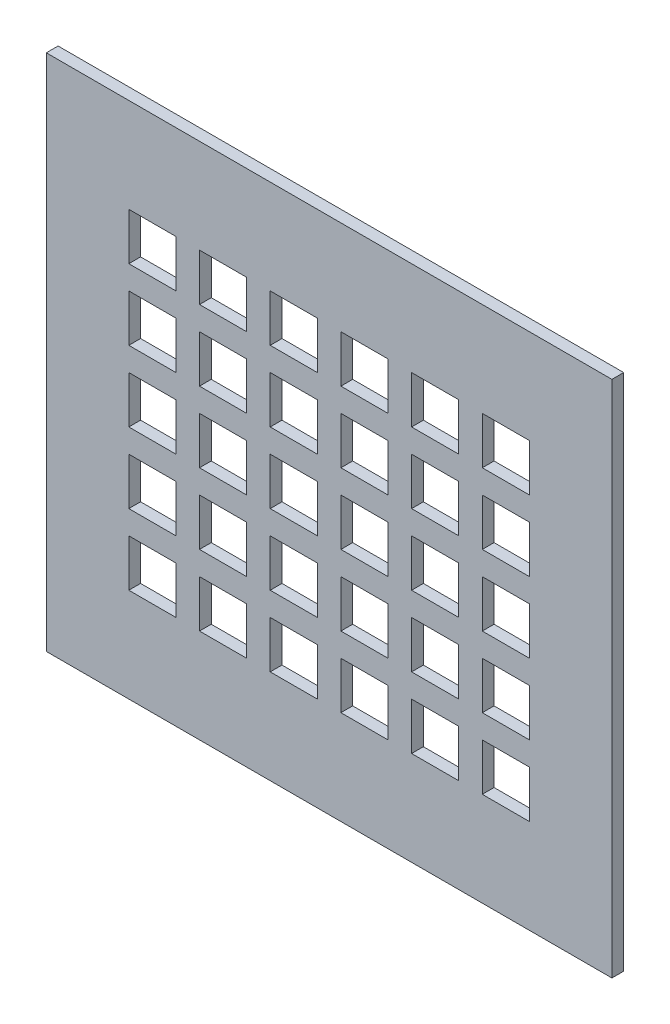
SolidWorks part; units mm, degrees
ref_plane "Front Plane" through (0, 0, 0) normal (0, 0, 1) x (1, 0, 0)
ref_plane "Top Plane" through (0, 0, 0) normal (0, 1, 0) x (1, 0, 0)
ref_plane "Right Plane" through (0, 0, 0) normal (1, 0, 0) x (0, 0, -1)
sketch "Sketch1" plane through (0, 0, 0) normal (0, 0, 1) x (1, 0, 0)
  line L1 (-76.2, 69.85) -> (76.2, 69.85)
  line L2 (-76.2, 69.85) -> (-76.2, -69.85)
  line L3 (-76.2, -69.85) -> (76.2, -69.85)
  line L4 (76.2, 69.85) -> (76.2, -69.85)
  line L5 (-76.2, 69.85) -> (76.2, -69.85) construction
  line L6 (-76.2, -69.85) -> (76.2, 69.85) construction
  point P0 (0, 0)
  dimension "D1" = 152.4
  dimension "D2" = 139.7
extrude "Boss-Extrude1" add sketch "Sketch1" along normal blind 3.175
sketch "Sketch3" plane through (0, 0, 3.175) normal (0, 0, 1) x (1, 0, 0)
  line L0 (-76.2, -69.85) -> (76.2, -69.85) construction
  line L1 (-53.975, -31.75) -> (-41.275, -31.75)
  line L2 (-53.975, -31.75) -> (-53.975, -44.45)
  line L3 (-53.975, -44.45) -> (-41.275, -44.45)
  line L4 (-41.275, -31.75) -> (-41.275, -44.45)
  line L5 (-53.975, -31.75) -> (-41.275, -44.45) construction
  line L6 (-53.975, -44.45) -> (-47.625, -38.1) construction
  line L7 (-76.2, 69.85) -> (-76.2, -69.85) construction
  line L8 (-34.925, -44.45) -> (-22.225, -44.45)
  line L9 (-22.225, -31.75) -> (-22.225, -44.45)
  line L10 (-34.925, -31.75) -> (-22.225, -31.75)
  line L11 (-34.925, -31.75) -> (-34.925, -44.45)
  line L12 (-15.875, -44.45) -> (-3.175, -44.45)
  line L13 (-3.175, -31.75) -> (-3.175, -44.45)
  line L14 (-15.875, -31.75) -> (-3.175, -31.75)
  line L15 (-15.875, -31.75) -> (-15.875, -44.45)
  line L16 (3.175, -44.45) -> (15.875, -44.45)
  line L17 (15.875, -31.75) -> (15.875, -44.45)
  line L18 (3.175, -31.75) -> (15.875, -31.75)
  line L19 (3.175, -31.75) -> (3.175, -44.45)
  line L20 (22.225, -44.45) -> (34.925, -44.45)
  line L21 (34.925, -31.75) -> (34.925, -44.45)
  line L22 (22.225, -31.75) -> (34.925, -31.75)
  line L23 (22.225, -31.75) -> (22.225, -44.45)
  line L24 (41.275, -44.45) -> (53.975, -44.45)
  line L25 (53.975, -31.75) -> (53.975, -44.45)
  line L26 (41.275, -31.75) -> (53.975, -31.75)
  line L27 (41.275, -31.75) -> (41.275, -44.45)
  line L28 (-34.925, -25.4) -> (-22.225, -25.4)
  line L29 (-22.225, -12.7) -> (-22.225, -25.4)
  line L30 (-34.925, -12.7) -> (-22.225, -12.7)
  line L31 (-34.925, -12.7) -> (-34.925, -25.4)
  line L32 (-15.875, -25.4) -> (-3.175, -25.4)
  line L33 (-3.175, -12.7) -> (-3.175, -25.4)
  line L34 (-15.875, -12.7) -> (-3.175, -12.7)
  line L35 (-15.875, -12.7) -> (-15.875, -25.4)
  line L36 (3.175, -25.4) -> (15.875, -25.4)
  line L37 (15.875, -12.7) -> (15.875, -25.4)
  line L38 (3.175, -12.7) -> (15.875, -12.7)
  line L39 (3.175, -12.7) -> (3.175, -25.4)
  line L40 (22.225, -25.4) -> (34.925, -25.4)
  line L41 (34.925, -12.7) -> (34.925, -25.4)
  line L42 (22.225, -12.7) -> (34.925, -12.7)
  line L43 (22.225, -12.7) -> (22.225, -25.4)
  line L44 (41.275, -25.4) -> (53.975, -25.4)
  line L45 (53.975, -12.7) -> (53.975, -25.4)
  line L46 (41.275, -12.7) -> (53.975, -12.7)
  line L47 (41.275, -12.7) -> (41.275, -25.4)
  line L48 (-34.925, -6.35) -> (-22.225, -6.35)
  line L49 (-22.225, 6.35) -> (-22.225, -6.35)
  line L50 (-34.925, 6.35) -> (-22.225, 6.35)
  line L51 (-34.925, 6.35) -> (-34.925, -6.35)
  line L52 (-15.875, -6.35) -> (-3.175, -6.35)
  line L53 (-3.175, 6.35) -> (-3.175, -6.35)
  line L54 (-15.875, 6.35) -> (-3.175, 6.35)
  line L55 (-15.875, 6.35) -> (-15.875, -6.35)
  line L56 (3.175, -6.35) -> (15.875, -6.35)
  line L57 (15.875, 6.35) -> (15.875, -6.35)
  line L58 (3.175, 6.35) -> (15.875, 6.35)
  line L59 (3.175, 6.35) -> (3.175, -6.35)
  line L60 (22.225, -6.35) -> (34.925, -6.35)
  line L61 (34.925, 6.35) -> (34.925, -6.35)
  line L62 (22.225, 6.35) -> (34.925, 6.35)
  line L63 (22.225, 6.35) -> (22.225, -6.35)
  line L64 (41.275, -6.35) -> (53.975, -6.35)
  line L65 (53.975, 6.35) -> (53.975, -6.35)
  line L66 (41.275, 6.35) -> (53.975, 6.35)
  line L67 (41.275, 6.35) -> (41.275, -6.35)
  line L68 (-34.925, 12.7) -> (-22.225, 12.7)
  line L69 (-22.225, 25.4) -> (-22.225, 12.7)
  line L70 (-34.925, 25.4) -> (-22.225, 25.4)
  line L71 (-34.925, 25.4) -> (-34.925, 12.7)
  line L72 (-15.875, 12.7) -> (-3.175, 12.7)
  line L73 (-3.175, 25.4) -> (-3.175, 12.7)
  line L74 (-15.875, 25.4) -> (-3.175, 25.4)
  line L75 (-15.875, 25.4) -> (-15.875, 12.7)
  line L76 (3.175, 12.7) -> (15.875, 12.7)
  line L77 (15.875, 25.4) -> (15.875, 12.7)
  line L78 (3.175, 25.4) -> (15.875, 25.4)
  line L79 (3.175, 25.4) -> (3.175, 12.7)
  line L80 (22.225, 12.7) -> (34.925, 12.7)
  line L81 (34.925, 25.4) -> (34.925, 12.7)
  line L82 (22.225, 25.4) -> (34.925, 25.4)
  line L83 (22.225, 25.4) -> (22.225, 12.7)
  line L84 (41.275, 12.7) -> (53.975, 12.7)
  line L85 (53.975, 25.4) -> (53.975, 12.7)
  line L86 (41.275, 25.4) -> (53.975, 25.4)
  line L87 (41.275, 25.4) -> (41.275, 12.7)
  line L88 (-34.925, 31.75) -> (-22.225, 31.75)
  line L89 (-22.225, 44.45) -> (-22.225, 31.75)
  line L90 (-34.925, 44.45) -> (-22.225, 44.45)
  line L91 (-34.925, 44.45) -> (-34.925, 31.75)
  line L92 (-15.875, 31.75) -> (-3.175, 31.75)
  line L93 (-3.175, 44.45) -> (-3.175, 31.75)
  line L94 (-15.875, 44.45) -> (-3.175, 44.45)
  line L95 (-15.875, 44.45) -> (-15.875, 31.75)
  line L96 (3.175, 31.75) -> (15.875, 31.75)
  line L97 (15.875, 44.45) -> (15.875, 31.75)
  line L98 (3.175, 44.45) -> (15.875, 44.45)
  line L99 (3.175, 44.45) -> (3.175, 31.75)
  line L100 (22.225, 31.75) -> (34.925, 31.75)
  line L101 (34.925, 44.45) -> (34.925, 31.75)
  line L102 (22.225, 44.45) -> (34.925, 44.45)
  line L103 (22.225, 44.45) -> (22.225, 31.75)
  line L104 (41.275, 31.75) -> (53.975, 31.75)
  line L105 (53.975, 44.45) -> (53.975, 31.75)
  line L106 (41.275, 44.45) -> (53.975, 44.45)
  line L107 (41.275, 44.45) -> (41.275, 31.75)
  line L108 (-53.975, -25.4) -> (-41.275, -25.4)
  line L109 (-41.275, -12.7) -> (-41.275, -25.4)
  line L110 (-53.975, -12.7) -> (-41.275, -12.7)
  line L111 (-53.975, -12.7) -> (-53.975, -25.4)
  line L112 (-53.975, -6.35) -> (-41.275, -6.35)
  line L113 (-41.275, 6.35) -> (-41.275, -6.35)
  line L114 (-53.975, 6.35) -> (-41.275, 6.35)
  line L115 (-53.975, 6.35) -> (-53.975, -6.35)
  line L116 (-53.975, 12.7) -> (-41.275, 12.7)
  line L117 (-41.275, 25.4) -> (-41.275, 12.7)
  line L118 (-53.975, 25.4) -> (-41.275, 25.4)
  line L119 (-53.975, 25.4) -> (-53.975, 12.7)
  line L120 (-53.975, 31.75) -> (-41.275, 31.75)
  line L121 (-41.275, 44.45) -> (-41.275, 31.75)
  line L122 (-53.975, 44.45) -> (-41.275, 44.45)
  line L123 (-53.975, 44.45) -> (-53.975, 31.75)
  line L124 (-34.925, -31.75) -> (-22.225, -44.45) construction
  line L125 (-34.925, -44.45) -> (-28.575, -38.1) construction
  point P0 (-47.625, -38.1)
  point P7 (-47.625, -44.45)
  dimension "D1" = 25.4
  dimension "D2" = 12.7
  dimension "D3" = 12.7
  dimension "D4" = 22.225
  dimension "D5" = 6
  dimension "D6" = 5
extrude "Cut-Extrude1" cut sketch "Sketch3" against normal through all
sketch "Sketch4" plane through (0, 0, 3.175) normal (0, 0, 1) x (1, 0, 0)
  line L0 (-76.2, -69.85) -> (76.2, 69.85) construction
  line L1 (-76.2, 69.85) -> (76.2, -69.85) construction
  line L2 (76.2, 69.85) -> (-76.2, 69.85) construction
  line L5 (-76.2, -69.85) -> (76.2, -69.85) construction
  point P8 (-65.8091, -60.325)
  point P9 (-65.8091, 60.325)
  point P10 (65.8091, 60.325)
  point P11 (65.8091, -60.325)
  dimension "D1" = 9.525
  dimension "D2" = 9.525
ref_plane "Plane1" through (0, -60.325, 0) normal (0, -1, 0) x (-1, 0, 0)
ref_plane "Plane2" through (0, 0, 1.5875) normal (0, 0, -1) x (-1, 0, 0)
